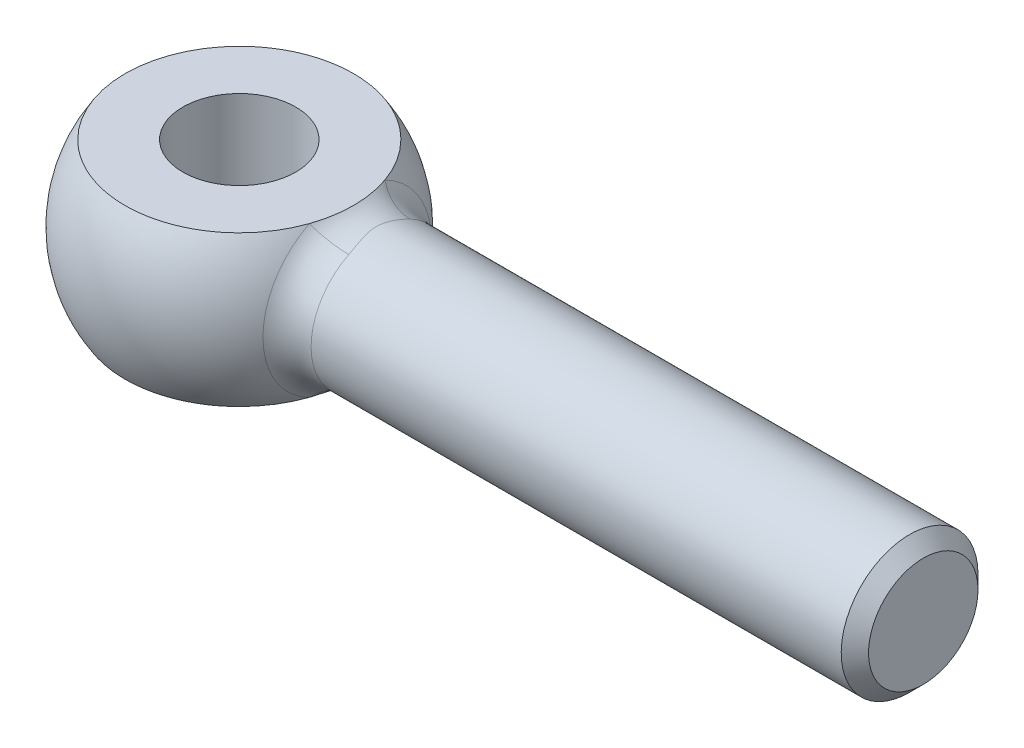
SolidWorks part; units mm, degrees
ref_plane "Ebene vorne" through (0, 0, 0) normal (0, 0, 1) x (1, 0, 0)
ref_plane "Ebene oben" through (0, 0, 0) normal (0, 1, 0) x (1, 0, 0)
ref_plane "Ebene rechts" through (0, 0, 0) normal (1, 0, 0) x (0, 0, -1)
sketch "Skizze1" plane through (0, 0, 0) normal (0, 1, 0) x (1, 0, 0)
  line L0 (0, 20) -> (0, -20) construction
  line L1 (0, 20) -> (0, -20)
  arc A0 (0, 20) -> (0, -20) centre (0, 0) ccw
  dimension "D1" = 40
revolve "Rotation2" add sketch "Skizze1" angle 360 about L0
sketch "Skizze2" plane through (0, 0, 0) normal (1, 0, 0) x (0, 0, -1)
  circle A0 centre (0, 0) radius 10
  dimension "D1" = 20
extrude "Aufsatz-Linear austragen1" add sketch "Skizze2" along normal blind 100
sketch "Skizze3" plane through (0, 0, 0) normal (0, 0, 1) x (1, 0, 0)
  line L0 (-16.7033, 11) -> (16.7033, 11)
  line L1 (-16.7033, -11) -> (16.7033, -11)
  line L2 (0, 0) -> (-20, 0) construction
  arc A0 (17.3205, 10) -> (17.3205, -10) centre (0, 0) ccw construction
  arc A1 (16.7033, 11) -> (-16.7033, 11) centre (0, 0) ccw
  arc A2 (-16.7033, -11) -> (16.7033, -11) centre (0, 0) ccw
  dimension "D1" = 22
extrude "Schnitt-Linear austragen1" cut sketch "Skizze3" against normal through all both and the other way through all
hole_wizard "Ø16.5 (16.5) Durchmesser Bohrung1" positions "Skizze4" profile "Skizze6" hole size "Ø16.5" standard "DIN"
sketch "Skizze4" plane through (0, 11, 0) normal (0, 1, 0) x (1, 0, 0)
  point P0 (0, 0)
sketch "Skizze6" plane through (0, 11, 0) normal (1, 0, 0) x (0, 0, 1)
  line L0 (0, 0) -> (0, 22)
  line L1 (0, 22) -> (8.25, 22)
  line L2 (8.25, 22) -> (8.25, 0)
  line L5 (8.25, 0) -> (0, 0)
  line L11 (0, -6.35) -> (0, 107.95) construction
  dimension "Bohrerdurchmesser" = 16.5
  dimension "Bohrungstiefe" = 22
fillet "Verrundung1" radius 6 1 edges at (17.3205, 0, 10)
chamfer "Fase1" distance 2 angle 45 1 edges at (100, 0, -10)
